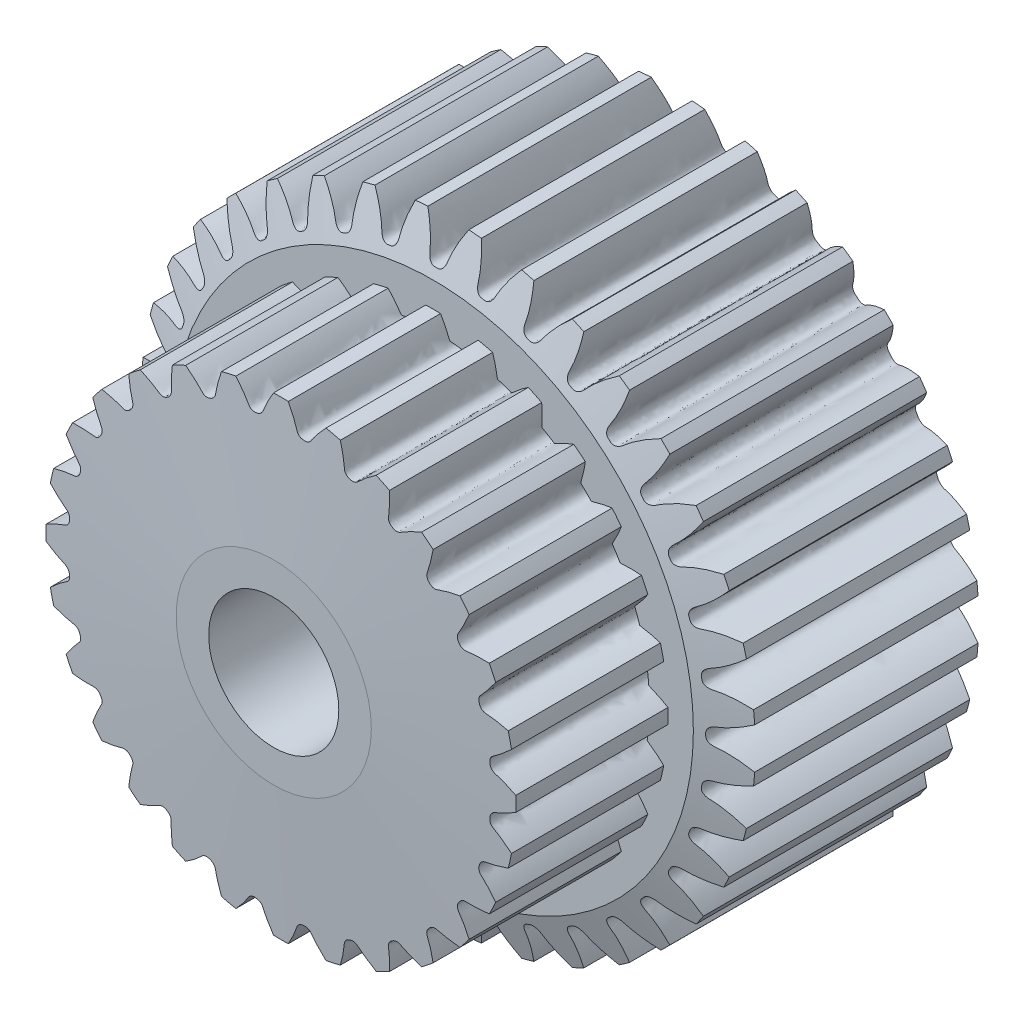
SolidWorks part; units mm, degrees
other "<217-2724-001 Rev1_Sun_Driver01>-<Imported2>"
other "<217-2724-001 Rev1_Sun_Driver01>-<Imported1>"
ref_plane "Front Plane" through (0, 0, 0) normal (0, 0, 1) x (1, 0, 0)
ref_plane "Top Plane" through (0, 0, 0) normal (0, 1, 0) x (1, 0, 0)
ref_plane "Right Plane" through (0, 0, 0) normal (1, 0, 0) x (0, 0, -1)
mirrored part "217-2724-001 Rev1_Sun_Driver01_Mirrored"
